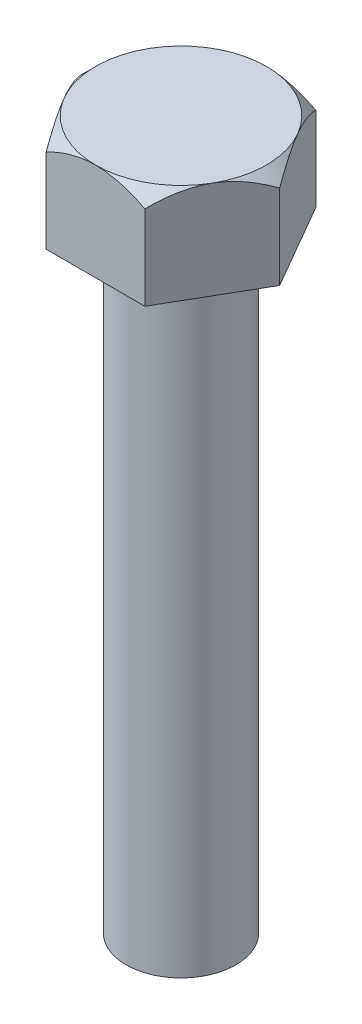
SolidWorks part; units mm, degrees
ref_plane "Front Plane" through (0, 0, 0) normal (0, 0, 1) x (1, 0, 0)
ref_plane "Top Plane" through (0, 0, 0) normal (0, 1, 0) x (1, 0, 0)
ref_plane "Right Plane" through (0, 0, 0) normal (1, 0, 0) x (0, 0, -1)
sketch "Sketch1" plane through (0, 0, 0) normal (0, 1, 0) x (1, 0, 0)
  line L1 (4.0415, 0) -> (2.0207, 3.5)
  line L2 (2.0207, 3.5) -> (-2.0207, 3.5)
  line L3 (-2.0207, 3.5) -> (-4.0415, 0)
  line L4 (-4.0415, 0) -> (-2.0207, -3.5)
  line L5 (-2.0207, -3.5) -> (2.0207, -3.5)
  line L6 (2.0207, -3.5) -> (4.0415, 0)
  circle A0 centre (0, 0) radius 3.5 construction
  dimension "D1" = 7
extrude "Boss-Extrude1" add sketch "Sketch1" along normal blind 4
sketch "Sketch2" plane through (0, 0, 0) normal (0, -1, 0) x (1, 0, 0)
  circle A0 centre (0, 0) radius 2.25
  dimension "D1" = 4.5
extrude "Boss-Extrude2" add sketch "Sketch2" along normal blind 25
sketch "Sketch3" plane through (0, 4, 0) normal (0, 1, 0) x (1, 0, 0)
  circle A0 centre (0, 0) radius 3.5
extrude "Cut-Extrude1" cut sketch "Sketch3" against normal blind 50 draft 45 flip side to cut
